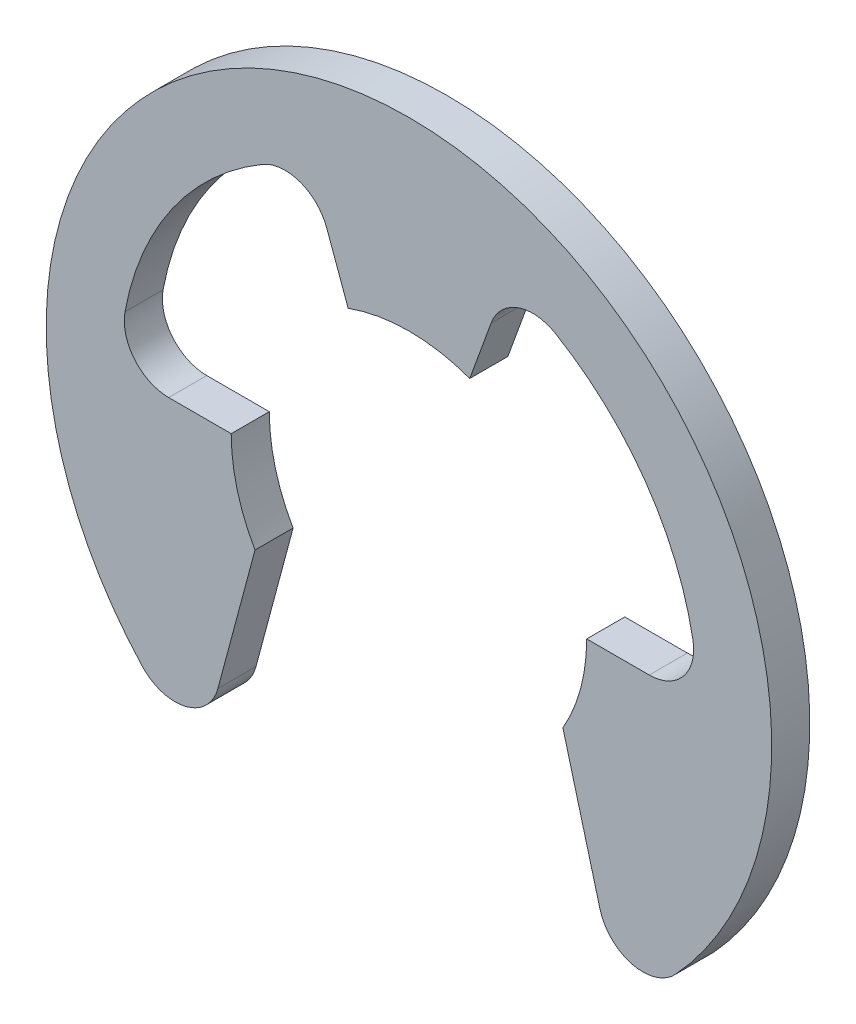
SolidWorks part; units mm, degrees
ref_plane "Plane1" through (0, 0, 0) normal (0, 0, 1) x (1, 0, 0)
ref_plane "Plane2" through (0, 0, 0) normal (0, 1, 0) x (1, 0, 0)
ref_plane "Plane3" through (0, 0, 0) normal (1, 0, 0) x (0, 0, -1)
sketch "Clipboard" plane through (0, 0, 0) normal (0, 0, 1) x (1, 0, 0)
  circle A0 centre (0, 0) radius 4.9784
  circle A1 centre (0, 0) radius 10.16
  dimension "FreeDia" = 9.9568
  dimension "FreeOutsideDia" = 20.32
sketch "BodySke" plane through (0, 0, 0) normal (0, 0, 1) x (1, 0, 0)
  line L0 (0, 0) -> (1.7027, 4.6782) construction
  line L1 (0, 0) -> (-1.7027, 4.6782) construction
  line L2 (0, 0.6037) -> (0, -0.6192) construction
  line L3 (0, 0) -> (1.2813, -0.7398) construction
  line L4 (0, 0) -> (-1.295, -0.7477) construction
  line L5 (0, 0) -> (4.9784, 0) construction
  line L6 (0, 0) -> (-4.9784, 0) construction
  line L7 (4.3114, -2.4892) -> (5.3511, -6.3692)
  line L8 (-4.3114, -2.4892) -> (-5.3511, -6.3692)
  line L9 (4.9784, 0) -> (6.7298, 0)
  line L10 (-4.9784, 0) -> (-6.7298, 0)
  line L11 (-1.7027, 4.6782) -> (-2.3017, 6.324)
  line L12 (1.7027, 4.6782) -> (2.3017, 6.324)
  arc A0 (-4.9784, 0) -> (-4.3114, -2.4892) centre (0, 0) ccw
  arc A1 (7.4661, -6.8908) -> (-7.4661, -6.8908) centre (0, 0) ccw
  arc A2 (-4.1009, 6.9705) -> (-7.9527, 1.4696) centre (0, 0) ccw
  arc A3 (7.9527, 1.4696) -> (4.1009, 6.9705) centre (0, 0) ccw
  circle A4 centre (0, 0) radius 10.16 construction
  arc A5 (1.7027, 4.6782) -> (-1.7027, 4.6782) centre (0, 0) ccw
  arc A6 (4.3114, -2.4892) -> (4.9784, 0) centre (0, 0) ccw
  circle A7 centre (0, 0) radius 4.9784 construction
  arc A8 (5.3511, -6.3692) -> (7.4661, -6.8908) centre (6.5523, -6.0473) ccw
  arc A9 (-5.3511, -6.3692) -> (-7.4661, -6.8908) centre (-6.5523, -6.0473) cw
  arc A10 (-6.7298, 0) -> (-7.9527, 1.4696) centre (-6.7298, 1.2436) cw
  arc A11 (-2.3017, 6.324) -> (-4.1009, 6.9705) centre (-3.4703, 5.8987) ccw
  arc A12 (2.3017, 6.324) -> (4.1009, 6.9705) centre (3.4703, 5.8987) cw
  arc A13 (6.7298, 0) -> (7.9527, 1.4696) centre (6.7298, 1.2436) ccw
  point P28 (-8.0874, 0)
  point P36 (8.0874, 0)
  dimension "D1" = 40
  dimension "D5" = 8.0874
  dimension "D3" = 1.2436
  dimension "D2" = 30
  dimension "D4" = 15
extrude "Body" add sketch "BodySke" against normal blind 1.0668
equation "\"D5@BodySke\" =  ( 3 / 5 * \"FreeOutsideDia@Clipboard\" + 2 / 5 * \"FreeDia@Clipboard\" )  / 2"
equation "\"D3@BodySke\" =  ( \"D5@BodySke\" * 2 - \"FreeDia@Clipboard\" )  / 2 / 2.5"
